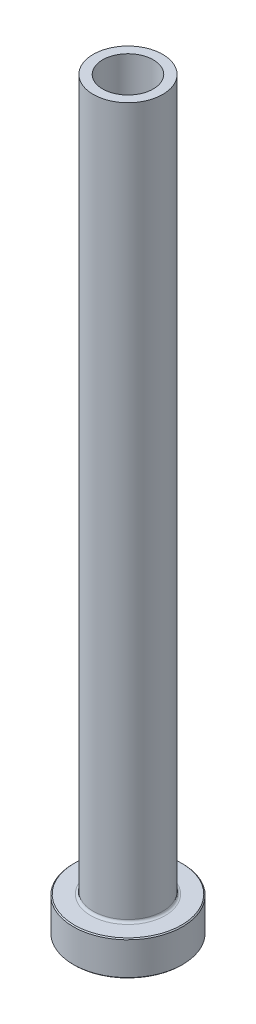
SolidWorks part; units mm, degrees
ref_plane "Front Plane" through (0, 0, 0) normal (0, 0, 1) x (1, 0, 0)
ref_plane "Top Plane" through (0, 0, 0) normal (0, 1, 0) x (1, 0, 0)
ref_plane "Right Plane" through (0, 0, 0) normal (1, 0, 0) x (0, 0, -1)
sketch "Sketch1" plane through (0, 0, 0) normal (0, 0, 1) x (1, 0, 0)
  line L0 (-5.1, 150) -> (-7, 150)
  line L1 (-7, 150) -> (-7, 7)
  line L2 (-7, 7) -> (-11, 7)
  line L3 (-11, 7) -> (-11, 0)
  line L4 (12.1, 0) -> (-12.1, 0) construction
  line L5 (-11, 0) -> (-5.35, 0)
  line L6 (-5.1, 95) -> (-5.1, 150)
  line L7 (0, 92.1877) -> (0, -15.5353) construction
  line L8 (0, -12.1) -> (0, 12.1) construction
  line L9 (-5.1, 95) -> (-5.35, 83)
  line L10 (-5.35, 83) -> (-5.35, 0)
  dimension "D1" = 0.25
  dimension "ID" = 10.2
  dimension "OD" = 14
  dimension "L" = 150
  dimension "H" = 22
  dimension "T" = 7
  dimension "N" = 55
  dimension "D2" = 12
revolve "Revolve1" add sketch "Sketch1" angle 360 about L7
fillet "Fillet1" radius 0.5 1 edges at (0, 7, 7)
chamfer "Chamfer1" distance 0.2 angle 45 2 edges at (0, 7, 11) (0, 0, 11)
chamfer "Chamfer3" distance 0.5 angle 45 1 edges at (0, 0, 5.35)
